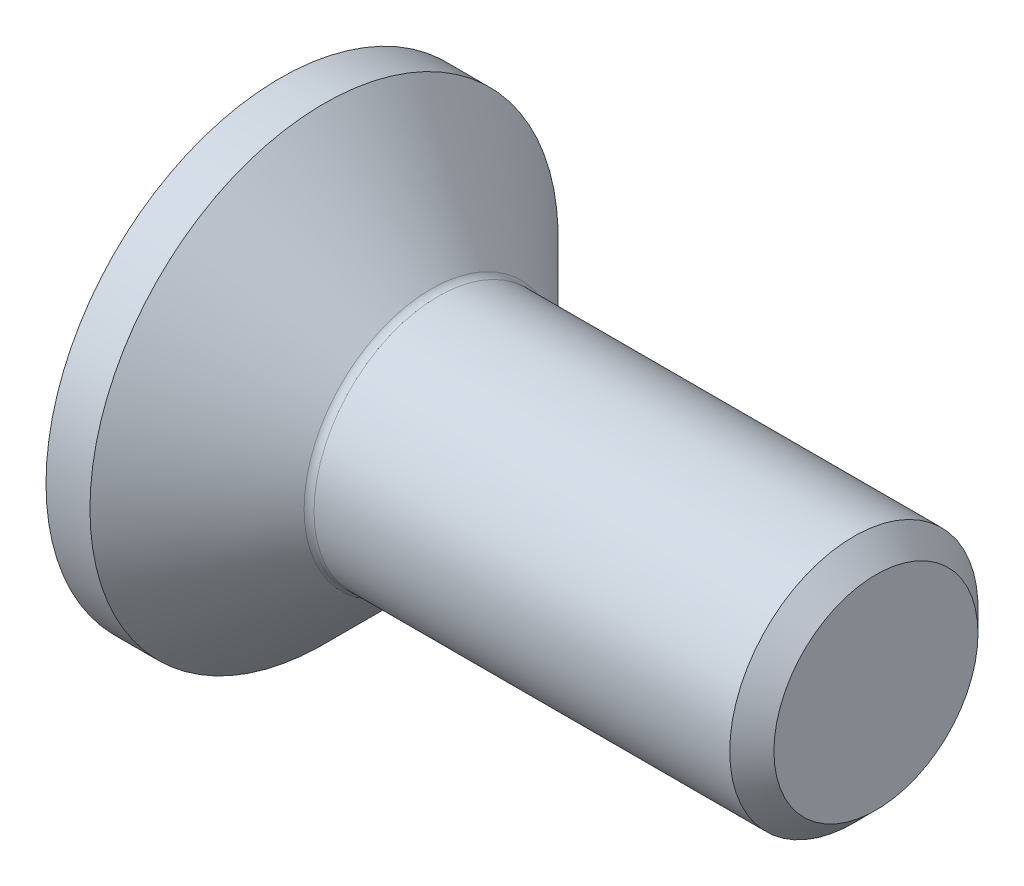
SolidWorks part; units mm, degrees
revolve "PreBroach" cut sketch "Sketch2"
sketch "Sketch2"
  line L0 (0, 1.5) -> (1.9, 1.5)
  line L1 (1.9, 1.5) -> (2.766, 0)
  line L2 (0, 0) -> (127, 0) construction
  line L3 (2.766, 0) -> (0, 0)
  line L4 (0, 0) -> (0, 1.5)
  line L5 (0, -1.5) -> (1.9, -1.5) construction
  line L6 (0, 0) -> (47.625, 0) construction
  line L8 (0, 4.715) -> (0, -4.715) construction
revolve "BaseBody" add sketch "BodySke"
sketch "BodySke" plane through (0, 0, 0) normal (0, 0, 1) x (1, 0, 0)
  line L0 (0, 0) -> (0, 4.715)
  line L1 (0.885, 4.715) -> (3.1, 2.5)
  line L2 (0, 4.715) -> (0.885, 4.715)
  line L3 (3.1, 2.5) -> (11.555, 2.5)
  line L4 (12, 2.055) -> (12, 0)
  line L5 (12, 0) -> (0, 0)
  line L6 (0, 0) -> (127, 0) construction
  line L7 (0.885, -4.715) -> (3.1, -2.5) construction
  line L8 (12, 2.055) -> (11.555, 2.5)
  line L9 (0, -4.715) -> (0.885, -4.715) construction
  line L10 (12, -2.055) -> (11.555, -2.5) construction
  line L11 (3.9, 8.85) -> (3.9, -13.375) construction
  line L12 (0, 19.05) -> (0, -3.175) construction
fillet "Fillet1" radius 0.2 1 edges at (3.1, 0, 2.5)
ref_plane "Plane1" through (0, 0, 0) normal (0, 0, 1) x (1, 0, 0)
ref_plane "Plane2" through (0, 0, 0) normal (0, 1, 0) x (1, 0, 0)
ref_plane "Plane3" through (0, 0, 0) normal (1, 0, 0) x (0, 0, -1)
sketch "Sketch3" plane through (0, 0, 0) normal (-1, 0, 0) x (0, 0, 1)
  line L0 (-1.5, -0.866) -> (-1.5, 0.866)
  line L1 (-1.5, 0.866) -> (0, 1.7321)
  line L2 (0, 1.7321) -> (1.5, 0.866)
  line L3 (1.5, 0.866) -> (1.5, -0.866)
  line L4 (1.5, -0.866) -> (0, -1.7321)
  line L5 (0, -1.7321) -> (-1.5, -0.866)
extrude "Hex" cut sketch "Sketch3" against normal blind 1.9
sketch "ThdSchSke" plane through (0, 0, 0) normal (0, 0, 1) x (1, 0, 0)
  line L0 (5.5, -2.055) -> (5.1884, -2.5)
  line L1 (5.5, -2.055) -> (5.8116, -2.5)
  line L2 (5.8116, -2.5) -> (5.8116, -3.125)
  line L3 (-3.175, 0) -> (5.1513, 0) construction
  line L4 (0, 4.715) -> (0, -4.715) construction
  line L5 (5.8116, -3.125) -> (5.1884, -3.125)
  line L6 (5.1884, -3.125) -> (5.1884, -2.5)
revolve "ThreadSchematic" [suppressed] cut sketch "ThdSchSke" angle 360 about L3
pattern_linear "ThdSchPat" [suppressed]
equation "\"Thread_minor@ThreadCosmetic\"  =  \"Minor_dia@BodySke\""
equation "\"D1@Sketch3\" = \"Hex_size@Sketch3\" / 2"
equation "\"D2@Sketch3\" = \"D1@Sketch3\""
equation "\"D3@Sketch3\" = \"Hex_size@Sketch3\""
equation "\"Thread_length@ThreadCosmetic\" = ((sgn( (\"Length@BodySke\" - \"Advance@BodySke\" * 3.0 - \"Head_ht@BodySke\" ) - \"Thread_nom@BodySke\" )-1)*( (\"Length@BodySke\" - \"Advance@BodySke\" * 3.0 - \"Head_ht@BodySke\" "
equation "\"Thread_minor@ThdSchSke\" = \"Minor_dia@BodySke\""
equation "\"Diameter@ThdSchSke\" = \"Diameter@BodySke\""
equation "\"Overcut@ThdSchSke\" = \"Diameter@BodySke\" * 1.25"
equation "\"Start@ThdSchSke\" = 0.000001 + \"Length@BodySke\" - \"Thread_length@ThreadCosmetic\"  '---Countersunk---"
equation "\"Num_threads@ThdSchPat\" = int( \"Thread_length@ThreadCosmetic\" / \"Advance@BodySke\" + 0.999 )  + 1"
equation "\"Advance@ThdSchPat\" = \"Thread_length@ThreadCosmetic\" /  (\"Num_threads@ThdSchPat\" - 1) 'relax it"
equation "\"Num_threads@ThdSchPat\" = \"Num_threads@ThdSchPat\" - sgn( \"Num_threads@ThdSchPat\" - 1) '---chamfered tips only---"
